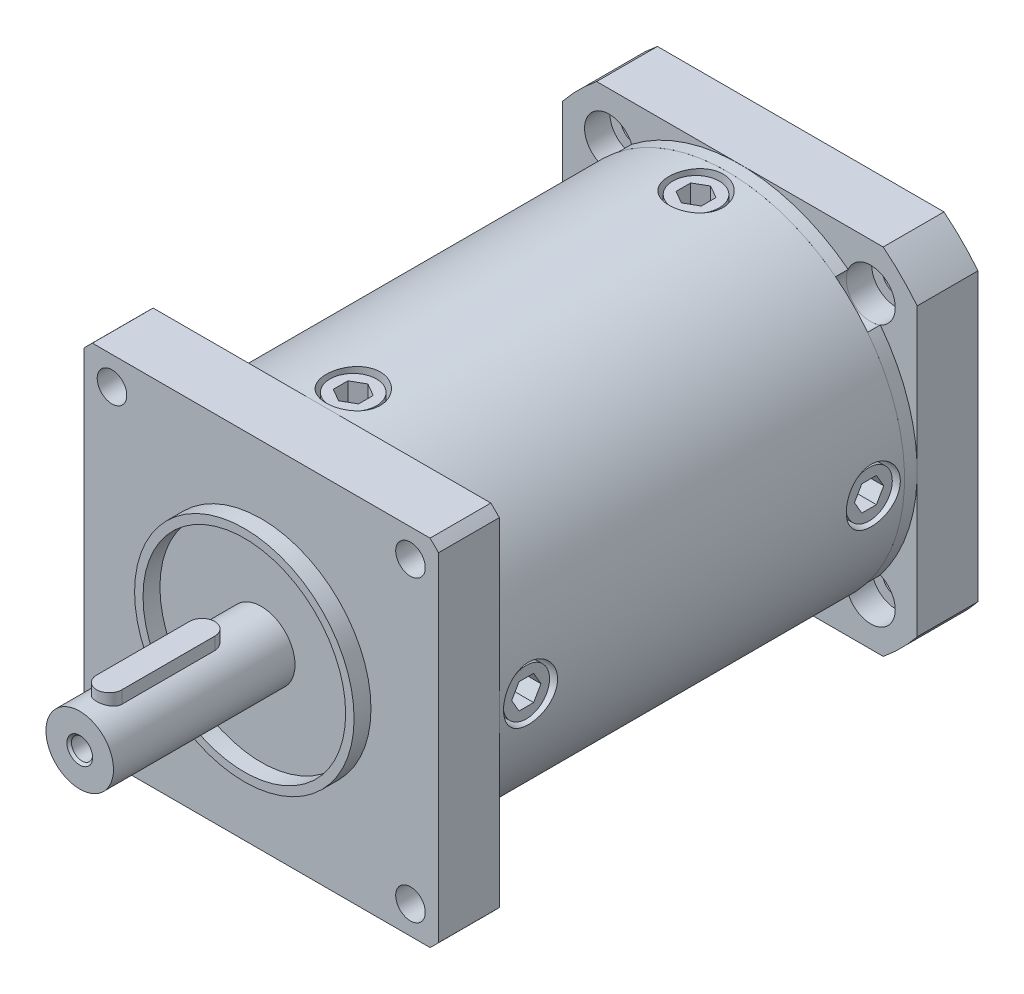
SolidWorks part; units mm, degrees
ref_plane "前视基准面" through (0, 0, 0) normal (0, 0, 1) x (1, 0, 0)
ref_plane "上视基准面" through (0, 0, 0) normal (0, 1, 0) x (1, 0, 0)
ref_plane "右视基准面" through (0, 0, 0) normal (1, 0, 0) x (0, 0, -1)
sketch "草图1" plane through (0, 0, 0) normal (0, 0, 1) x (1, 0, 0)
  line L1 (-20, -21) -> (20, -21)
  line L2 (-21, -20) -> (-21, 20)
  line L3 (-20, 21) -> (20, 21)
  line L4 (21, -20) -> (21, 20)
  line L5 (0, 21) -> (0, -21) construction
  line L6 (-21, 0) -> (21, 0) construction
  arc A0 (-20, 21) -> (-21, 20) centre (0, 0) ccw
  arc A1 (21, 20) -> (20, 21) centre (0, 0) ccw
  arc A2 (20, -21) -> (21, -20) centre (0, 0) ccw
  arc A3 (-21, -20) -> (-20, -21) centre (0, 0) ccw
  arc A4 (-21, -13.5647) -> (-21, 13.5647) centre (0, 0) ccw construction
  circle A5 centre (-17.6777, 17.6777) radius 1.75
  circle A6 centre (17.6777, 17.6777) radius 1.75
  circle A7 centre (17.6777, -17.6777) radius 1.75
  circle A8 centre (-17.6777, -17.6777) radius 1.75
  point P0 (0, 0)
  point P25 (0, 0)
  dimension "D3" = 3.5
  dimension "D4" = 4
extrude "凸台-拉伸2" add sketch "草图1" along normal blind 7.2
sketch "草图15" plane through (0, 0, 0) normal (0, 0, -1) x (-1, 0, 0)
  circle A0 centre (0, 0) radius 21
  dimension "D1" = 42
extrude "凸台-拉伸8" add sketch "草图15" along normal blind 48
sketch "草图17" plane through (0, 0, 7.2) normal (0, 0, 1) x (1, 0, 0)
  circle A0 centre (0, 0) radius 13
  circle A1 centre (0, 0) radius 12
  dimension "D1" = 26
  dimension "D2" = 24
extrude "凸台-拉伸9" add sketch "草图17" along normal blind 2
sketch "草图18" plane through (0, 0, 7.2) normal (0, 0, 1) x (1, 0, 0)
  circle A0 centre (0, 0) radius 4
  dimension "D1" = 8
extrude "凸台-拉伸10" add sketch "草图18" along normal blind 21.5
hole_wizard "M3 螺纹孔1" positions "草图22" profile "草图23" tap size "M3" standard "GB"
sketch "草图22" plane through (0, 0, 28.7) normal (0, 0, 1) x (1, 0, 0)
  point P0 (0, 0)
sketch "草图23" plane through (0, 0, 28.7) normal (1, 0, 0) x (0, -1, 0)
  line L0 (0, 0) -> (0, 11.7511)
  line L1 (0, 11.7511) -> (1.25, 11)
  line L2 (1.25, 11) -> (1.25, 0.275)
  line L3 (1.25, 0.275) -> (1.525, 0)
  line L5 (1.525, 0) -> (0, 0)
  line L6 (-1.25, 0.275) -> (-1.525, 0) construction
  line L10 (0, 11.7511) -> (-1.25, 11) construction
  line L11 (0, -6.35) -> (0, 107.95) construction
  dimension "螺纹孔钻头直径" = 2.5
  dimension "螺纹孔钻头深度" = 11
  dimension "近端锥形沉头孔直径" = 3.05
  dimension "近端锥形沉头孔角度" = 90
  dimension "导头角度" = 118
sketch "草图24" plane through (0, 0, 0) normal (0, 1, 0) x (1, 0, 0)
  line L0 (0, -14.2) -> (0, -25.2) construction
  line L2 (1.5, -14.2) -> (1.5, -25.2)
  line L3 (-1.5, -14.2) -> (-1.5, -25.2)
  line L4 (-4, -28.7) -> (4, -28.7) construction
  arc A0 (1.5, -14.2) -> (-1.5, -14.2) centre (0, -14.2) ccw
  arc A1 (-1.5, -25.2) -> (1.5, -25.2) centre (0, -25.2) ccw
  point P5 (0, -19.7)
  dimension "D1" = 3
  dimension "D2" = 11
  dimension "D3" = 3.5
extrude "凸台-拉伸11" add sketch "草图24" along normal blind 3 from offset 2.2
sketch "草图25" plane through (0, 0, -48) normal (0, 0, -1) x (-1, 0, 0)
  circle A0 centre (0, 0) radius 21
  dimension "D1" = 42
extrude "凸台-拉伸12" add sketch "草图25" along normal blind 1.5 separate body
sketch "草图26" plane through (0, 0, -49.5) normal (0, 0, -1) x (-1, 0, 0)
  line L1 (-16.9706, 21) -> (16.9706, 21)
  line L2 (-21, 16.9706) -> (-21, -16.9706)
  line L3 (-16.9706, -21) -> (16.9706, -21)
  line L4 (21, 16.9706) -> (21, -16.9706)
  line L5 (0, -21) -> (0, 21) construction
  line L6 (-21, 0) -> (21, 0) construction
  line L7 (-15.5, 15.5) -> (15.5, 15.5) construction
  line L8 (-15.5, 15.5) -> (-15.5, -15.5) construction
  line L9 (-15.5, -15.5) -> (15.5, -15.5) construction
  line L10 (15.5, 15.5) -> (15.5, -15.5) construction
  line L11 (0, -15.5) -> (0, 15.5) construction
  line L12 (-15.5, 0) -> (15.5, 0) construction
  arc A0 (16.9706, -21) -> (21, -16.9706) centre (0, 0) ccw
  arc A1 (-21, -16.9706) -> (-16.9706, -21) centre (0, 0) ccw
  arc A2 (-16.9706, 21) -> (-21, 16.9706) centre (0, 0) ccw
  arc A3 (21, 16.9706) -> (16.9706, 21) centre (0, 0) ccw
  circle A4 centre (-15.5, 15.5) radius 1.6
  circle A5 centre (15.5, 15.5) radius 1.6
  circle A6 centre (15.5, -15.5) radius 1.6
  circle A7 centre (-15.5, -15.5) radius 1.6
  point P0 (0, 0)
  point P22 (0, 0)
  dimension "D3" = 54
  dimension "D4" = 3.2
  dimension "D1" = 31
  dimension "D2" = 31
  dimension "D5" = 4
extrude "凸台-拉伸13" add sketch "草图26" along normal blind 7.2 separate body
sketch "草图27" plane through (0, 0, -56.7) normal (0, 0, -1) x (-1, 0, 0)
  circle A0 centre (0, 0) radius 11
  dimension "D1" = 22
extrude "切除-拉伸1" cut sketch "草图27" against normal blind 3
sketch "草图28" plane through (0, 0, -53.7) normal (0, 0, -1) x (-1, 0, 0)
  circle A0 centre (0, 0) radius 10
  dimension "D1" = 20
extrude "切除-拉伸2" cut sketch "草图28" against normal blind 10
sketch "草图29" plane through (0, 0, -43.7) normal (0, 0, -1) x (-1, 0, 0)
  circle A0 centre (0, 0) radius 7.5
  dimension "D1" = 15
extrude "凸台-拉伸14" add sketch "草图29" along normal blind 8 separate body
sketch "草图30" plane through (0, 0, -51.7) normal (0, 0, -1) x (-1, 0, 0)
  line L1 (-1.5, 2) -> (1.5, 2)
  arc A0 (-1.5, 2) -> (1.5, 2) centre (0, 0) ccw
  point P8 (0, 2)
  dimension "D1" = 5
extrude "切除-拉伸3" cut sketch "草图30" against normal blind 7
hole_wizard "M3 螺纹孔2" positions "草图32" profile "草图33" tap size "M3" standard "GB"
sketch "草图32" plane through (0, 2, 0) normal (0, -1, 0) x (-1, 0, 0)
  point P0 (0, 49.7597)
  point P1 (0, 49.7597)
sketch "草图33" plane through (0, 2, -49.7597) normal (1, 0, 0) x (0, 0, -1)
  line L0 (0, 0) -> (0, 8.2511)
  line L1 (0, 8.2511) -> (1.25, 7.5)
  line L2 (1.25, 7.5) -> (1.25, 0)
  line L5 (1.25, 0) -> (0, 0)
  line L10 (0, 8.2511) -> (-1.25, 7.5) construction
  line L11 (0, -6.35) -> (0, 107.95) construction
  dimension "螺纹孔钻头直径" = 2.5
  dimension "螺纹孔钻头深度" = 7.5
  dimension "导头角度" = 118
sketch "草图37" plane through (0, 0, -48) normal (0, 0, 1) x (1, 0, 0)
  circle A0 centre (15.5, 15.5) radius 2.9
  circle A1 centre (15.5, -15.5) radius 2.9
  circle A2 centre (-15.5, -15.5) radius 2.9
  circle A3 centre (-15.5, 15.5) radius 2.9
  point P11 (0, 0)
  dimension "D1" = 5.8
  dimension "D2" = 4
extrude "切除-拉伸4" cut sketch "草图37" against normal blind 4.5
sketch "草图38" plane through (21, 0, 0) normal (1, 0, 0) x (0, 0, -1)
  line L4 (0, -20) -> (0, 0) construction
  line L7 (48, -21) -> (48, 21) construction
  circle A0 centre (3.7, 0) radius 3.2
  circle A1 centre (44.3, 0) radius 3.2
  dimension "D1" = 0.5
  dimension "D2" = 6.4
  dimension "D3" = 0.5
  dimension "D4" = 6.4
extrude "切除-拉伸5" cut sketch "草图38" against normal blind 3.5
sketch "草图39" plane through (17.5, 0, 0) normal (1, 0, 0) x (0, 0, -1)
  circle A0 centre (3.7, 0) radius 2.75
  circle A1 centre (44.3, 0) radius 2.75
  dimension "D1" = 5.5
  dimension "D2" = 5.5
extrude "凸台-拉伸15" add sketch "草图39" along normal blind 3
sketch "草图40" plane through (20.5, 0, 0) normal (1, 0, 0) x (0, 0, -1)
  line L1 (5.4321, 0) -> (4.566, 1.5)
  line L2 (4.566, 1.5) -> (2.834, 1.5)
  line L3 (2.834, 1.5) -> (1.9679, 0)
  line L4 (1.9679, 0) -> (2.834, -1.5)
  line L5 (2.834, -1.5) -> (4.566, -1.5)
  line L6 (4.566, -1.5) -> (5.4321, 0)
  line L7 (42.5679, 0) -> (43.434, -1.5)
  line L8 (43.434, -1.5) -> (45.166, -1.5)
  line L9 (45.166, -1.5) -> (46.0321, 0)
  line L10 (46.0321, 0) -> (45.166, 1.5)
  line L11 (45.166, 1.5) -> (43.434, 1.5)
  line L12 (43.434, 1.5) -> (42.5679, 0)
  circle A0 centre (3.7, 0) radius 1.5 construction
  circle A1 centre (44.3, 0) radius 1.5 construction
  dimension "D1" = 3
  dimension "D2" = 3
extrude "切除-拉伸6" cut sketch "草图40" against normal blind 3
pattern_circular "阵列(圆周)1" count 4 every 90 about axis through (0, 0, 0) along (0, 0, 1) of "切除-拉伸6", "凸台-拉伸15", "切除-拉伸5"
